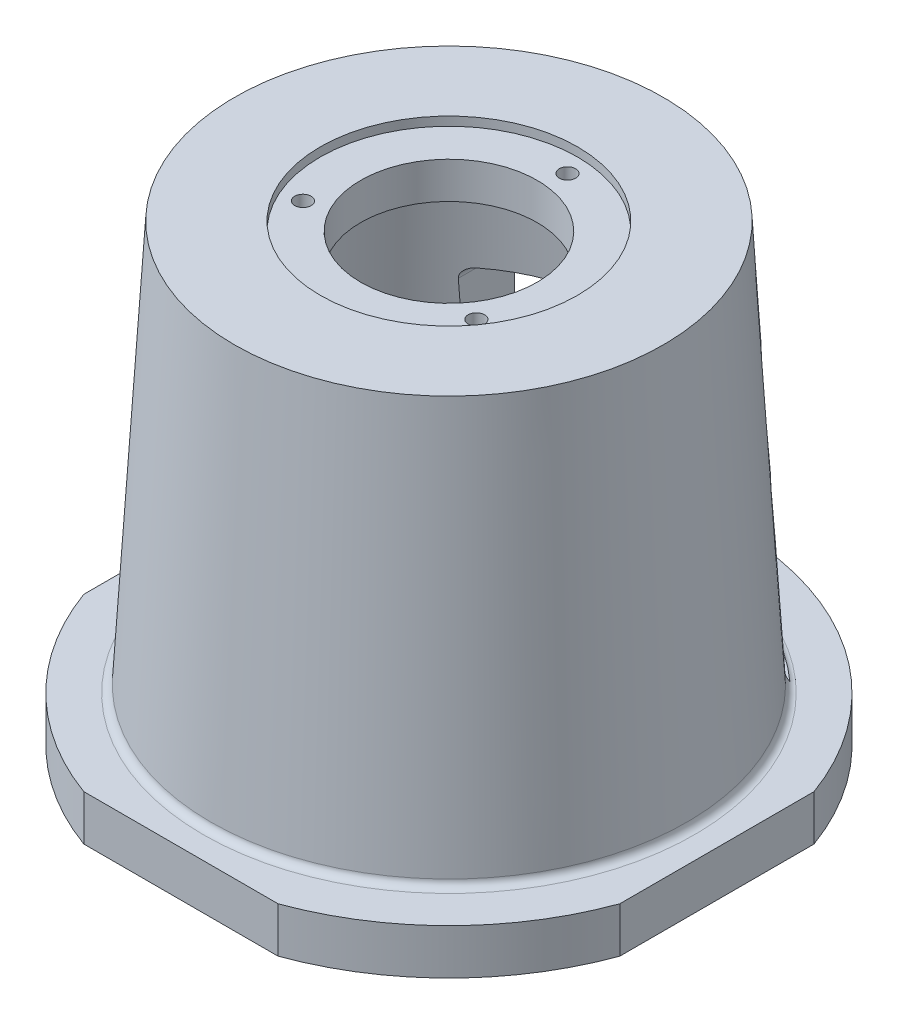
SolidWorks part; units mm, degrees
ref_plane "Face" through (0, 0, 0) normal (0, 0, 1) x (1, 0, 0)
ref_plane "Dessus" through (0, 0, 0) normal (0, 1, 0) x (1, 0, 0)
ref_plane "Droite" through (0, 0, 0) normal (1, 0, 0) x (0, 0, -1)
sketch "Esquisse1" plane through (0, 0, 0) normal (0, 0, 1) x (1, 0, 0)
  line L0 (-113, 0) -> (-73, 0)
  line L1 (-113, 0) -> (-113, 18)
  line L2 (-113, 18) -> (-94.5294, 18)
  line L3 (-94.5294, 18) -> (-85, 180)
  line L4 (-85, 180) -> (0, 180)
  line L5 (0, 180) -> (0, 162)
  line L6 (0, 193.7321) -> (0, -44.0337) construction
  line L7 (-73, 0) -> (-63.4706, 162)
  line L8 (-63.4706, 162) -> (0, 162)
  dimension "D1" = 73
  dimension "D2" = 113
  dimension "D3" = 85
  dimension "D4" = 93.366
  dimension "D5" = 162
  dimension "D6" = 180
revolve "Révolution1" add sketch "Esquisse1" angle 360 about L6
fillet "Congé1" radius 3 2 edges at (0, 18, 94.5294) (0, 162, 63.4706)
sketch "Esquisse2" plane through (0, 18, 0) normal (0, 1, 0) x (-1, 0, 0)
  line L0 (106.2391, 38.5) -> (135.0827, 38.5)
  line L1 (38.5, 106.2391) -> (-38.5, 106.2391)
  line L2 (38.5, 106.2391) -> (38.5, 135.0827)
  line L3 (38.5, 135.0827) -> (-38.5, 135.0827)
  line L4 (-38.5, 106.2391) -> (-38.5, 135.0827)
  line L5 (106.2391, -38.5) -> (106.2391, 38.5)
  line L6 (106.2391, -38.5) -> (135.0827, -38.5)
  line L7 (135.0827, -38.5) -> (135.0827, 38.5)
  line L12 (-106.2391, -38.5) -> (-135.0827, -38.5)
  line L13 (-106.2391, 38.5) -> (-106.2391, -38.5)
  line L14 (-106.2391, 38.5) -> (-135.0827, 38.5)
  line L15 (-135.0827, 38.5) -> (-135.0827, -38.5)
  line L29 (38.5, -106.2391) -> (38.5, -135.0827)
  line L30 (-38.5, -106.2391) -> (38.5, -106.2391)
  line L31 (-38.5, -106.2391) -> (-38.5, -135.0827)
  line L32 (-38.5, -135.0827) -> (38.5, -135.0827)
  circle A3 centre (0, 0) radius 113 construction
  dimension "D1" = 77
extrude "Enlèv. mat.-Extru.2" cut sketch "Esquisse2" against normal through all
sketch "Esquisse5" plane through (0, 0, 0) normal (0, 0, 1) x (1, 0, 0)
  line L0 (0, 197.5966) -> (0, 139.4723) construction
  line L1 (-51, 180) -> (-51, 176.5)
  line L2 (85, 180) -> (-85, 180) construction
  line L3 (-51, 176.5) -> (-35, 176.5)
  line L4 (-35, 176.5) -> (-35, 162)
  line L5 (-35, 162) -> (0, 162)
  line L6 (-51, 180) -> (0, 180)
  line L7 (-63.4706, 162) -> (63.4706, 162) construction
  line L8 (0, 162) -> (0, 180)
  dimension "D1" = 70
  dimension "D2" = 102
  dimension "D3" = 3.5
revolve "Enlèvement de matière-Révolution1" cut sketch "Esquisse5" angle 360 about L0
sketch "Esquisse9" plane through (0, 0, 0) normal (0, 0, 1) x (1, 0, 0)
  line L0 (41, 117.5) -> (-41, 117.5)
  line L2 (-41, 18.5) -> (41, 18.5)
  line L3 (106.2391, 18) -> (-106.2391, 18) construction
  line L4 (45, 113.5) -> (45, 22.5)
  line L5 (-45, 113.5) -> (-45, 22.5)
  line L7 (-94.3633, 20.8238) -> (94.3633, 20.8238) construction
  arc A0 (-41, 117.5) -> (-45, 113.5) centre (-41, 113.5) ccw
  arc A1 (41, 117.5) -> (45, 113.5) centre (41, 113.5) cw
  arc A2 (41, 18.5) -> (45, 22.5) centre (41, 22.5) ccw
  arc A3 (-45, 22.5) -> (-41, 18.5) centre (-41, 22.5) ccw
  point P14 (45, 117.5)
  point P17 (45, 18.5)
  point P20 (-45, 18.5)
  dimension "D7" = 91
  dimension "D8" = 4
  dimension "D2" = 4
  dimension "D1" = 0.5
  dimension "D3" = 45
  dimension "D4" = 45
  dimension "D5" = 90
  dimension "D6" = 99
extrude "Enlèv. mat.-Extru.3" cut sketch "Esquisse9" against normal through all
sketch "Esquisse10" plane through (0, 0, 0) normal (1, 0, 0) x (0, 0, -1)
  line L1 (95.6998, 18.5) -> (86.4723, 18.5) construction
  line L2 (93.4307, 18.5) -> (71, 18.5)
  line L3 (93.4307, 18.5) -> (93.4307, 164)
  line L4 (93.4307, 164) -> (71, 164)
  line L5 (71, 18.5) -> (71, 164)
  line L6 (85, 180) -> (-85, 180) construction
  line L8 (113, 0) -> (113, 18) construction
  dimension "D1" = 16
  dimension "D2" = 42
extrude "Enlèv. mat.-Extru.4" cut sketch "Esquisse10" against normal through all and the other way through all
other "Perçage1" parameters "D1"=30
sketch "Esquisse11" plane through (0, 176.5, 0) normal (0, 1, 0) x (-1, 0, 0)
  circle A0 centre (-35.7153, 24.8328) radius 3.25
  dimension "D1" = 6.5
  dimension "D2" = 43.5
pattern_circular "Répétition circulaire1" count 3 every 120 about axis through (0, 0, 0) along (0, 1, 0) of "Perçage1"
